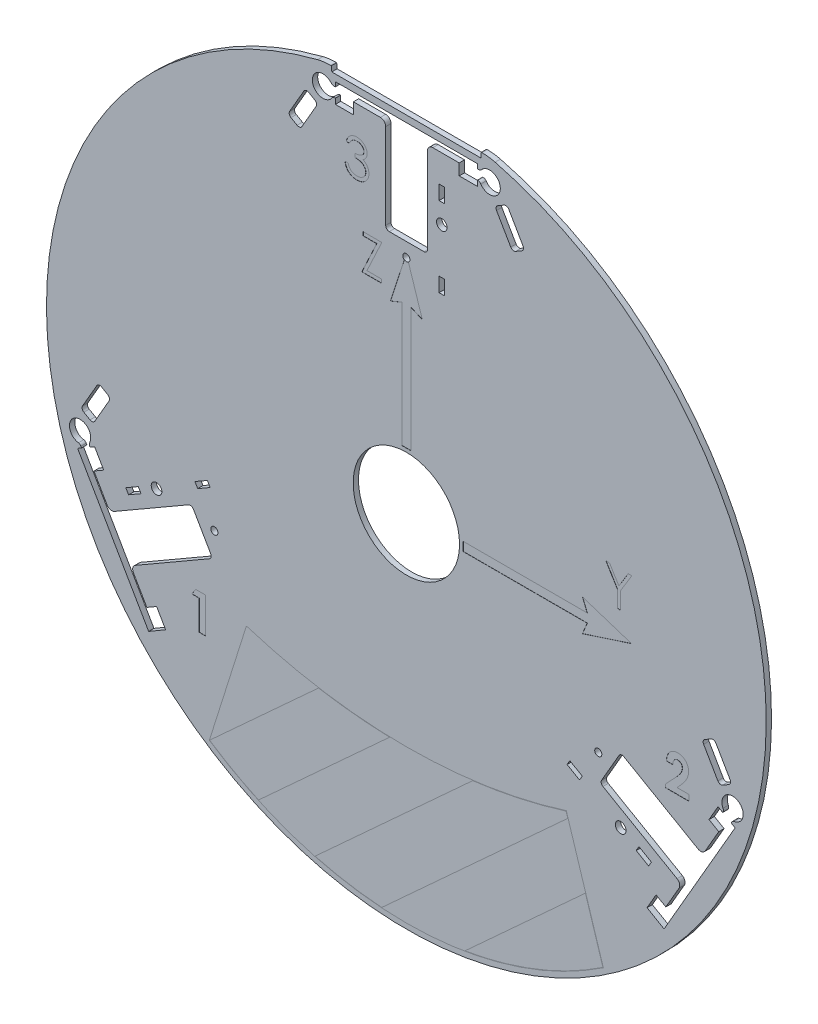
SolidWorks part; units mm, degrees
other "brep_1"
ref_plane "Plan de face" through (0, 0, 0) normal (0, 0, 1) x (1, 0, 0)
ref_plane "Plan de dessus" through (0, 0, 0) normal (0, 1, 0) x (1, 0, 0)
ref_plane "Plan de droite" through (0, 0, 0) normal (1, 0, 0) x (0, 0, -1)
imported_body "Importée1"
sketch "Esquisse1" plane through (0, 0, 3) normal (0, 0, 1) x (1, 0, 0)
  circle A0 centre (17.5562, 0.05) radius 115.8648
  circle A1 centre (17.5562, 0.05) radius 30
  dimension "D1" = 60
extrude "Boss.-Extru.1" add sketch "Esquisse1" against normal up to surface (3 mm away)
sketch "Esquisse2" plane through (0, 0, 3) normal (0, 0, 1) x (1, 0, 0)
  line L0 (17.5562, 0.05) -> (164.3243, 0.05) construction
  line L1 (49.5562, -2.45) -> (119.5562, -2.45)
  line L2 (49.5562, -2.45) -> (49.5562, 2.55)
  line L3 (49.5562, 2.55) -> (119.5562, 2.55)
  line L4 (17.5562, 0.05) -> (93.1702, 75.664) construction
  line L5 (144.5562, 0.05) -> (116.8649, -8.9475)
  line L6 (116.8649, -8.9475) -> (119.5562, -2.45)
  line L7 (116.8649, 9.0475) -> (119.5562, 2.55)
  line L8 (144.5562, 0.05) -> (116.8649, 9.0475)
  line L9 (8.5588, 99.3587) -> (15.0562, 102.05)
  line L10 (17.5562, 127.05) -> (8.5588, 99.3587)
  line L11 (17.5562, 127.05) -> (26.5537, 99.3587)
  line L12 (26.5537, 99.3587) -> (20.0562, 102.05)
  line L13 (20.0562, 32.05) -> (20.0562, 102.05)
  line L14 (15.0562, 32.05) -> (20.0562, 32.05)
  line L15 (15.0562, 32.05) -> (15.0562, 102.05)
  text T0 "Y" font "Century Gothic" height 20
  text T1 "Z" font "Century Gothic" height 20
  text T2 "<b>1</b>" font "Century Gothic" height 20
  text T3 "<b>2</b>" font "Century Gothic" height 20
  text T4 "3" font "Century Gothic" height 20
  dimension "D1" = 45
  dimension "D2" = 5
  dimension "D3" = 32
  dimension "D4" = 95
  dimension "D5" = 36
  dimension "D6" = 135
  dimension "D7" = 25
extrude "Enlèv. mat.-Extru.1" cut sketch "Esquisse2" against normal blind 0.1
sketch "Esquisse4" plane through (0, 0, 3) normal (0, 0, 1) x (1, 0, 0)
  line L0 (17.5562, 0.05) -> (17.5562, 225.0837) construction
  line L1 (-93.5579, -166.2439) -> (-72.6555, -99.95)
  line L2 (128.6704, -166.2439) -> (107.768, -99.95)
  line L3 (-72.6555, -99.95) -> (107.768, -99.95) construction
  line L4 (-93.2632, -165.9743) -> (-31.9876, -109.9184)
  line L5 (-65.8155, -181.5242) -> (8.1204, -113.8866)
  line L6 (-33.9197, -193.0051) -> (54.9612, -111.6955)
  line L7 (3.6803, -199.2676) -> (108.6077, -103.2784)
  line L8 (50.6076, -196.9973) -> (118.5577, -134.8356)
  line L9 (-93.322, -166.1609) -> (-93.2632, -165.9743)
  line L10 (128.4345, -166.1609) -> (118.5577, -134.8356)
  line L11 (108.6077, -103.2784) -> (107.6374, -100.2008)
  line L13 (128.4345, -166.1609) -> (107.6374, -100.2008) construction
  line L14 (-93.322, -166.1609) -> (-72.5249, -100.2008) construction
  arc A0 (-72.6555, -99.95) -> (107.768, -99.95) centre (17.5562, 186.1651) ccw
  arc A1 (-31.9876, -109.9184) -> (8.1204, -113.8866) centre (17.5562, 186.1651) ccw
  arc A2 (-93.5579, -166.2439) -> (128.6704, -166.2439) centre (17.5562, 0.05) ccw
  arc A3 (-93.322, -166.1609) -> (-65.8155, -181.5242) centre (17.5562, 0.05) ccw
  arc A4 (54.9612, -111.6955) -> (107.6374, -100.2008) centre (17.5562, 186.1651) ccw
  arc A5 (50.6076, -196.9973) -> (128.4345, -166.1609) centre (17.5562, 0.05) ccw
  arc A6 (-72.5249, -100.2008) -> (107.6374, -100.2008) centre (17.5562, 186.1651) ccw construction
  arc A7 (-33.9197, -193.0051) -> (3.6803, -199.2676) centre (17.5562, 0.05) ccw
  arc A8 (-93.322, -166.1609) -> (128.4345, -166.1609) centre (17.5562, 0.05) ccw construction
  dimension "D2" = 300
  dimension "D3" = 200
  dimension "D1" = 35
  dimension "D4" = 100
  dimension "D5" = 30
  dimension "D6" = 30
  dimension "D7" = 30
  dimension "D8" = 30
  dimension "D9" = 30
  dimension "D10" = 0.2
